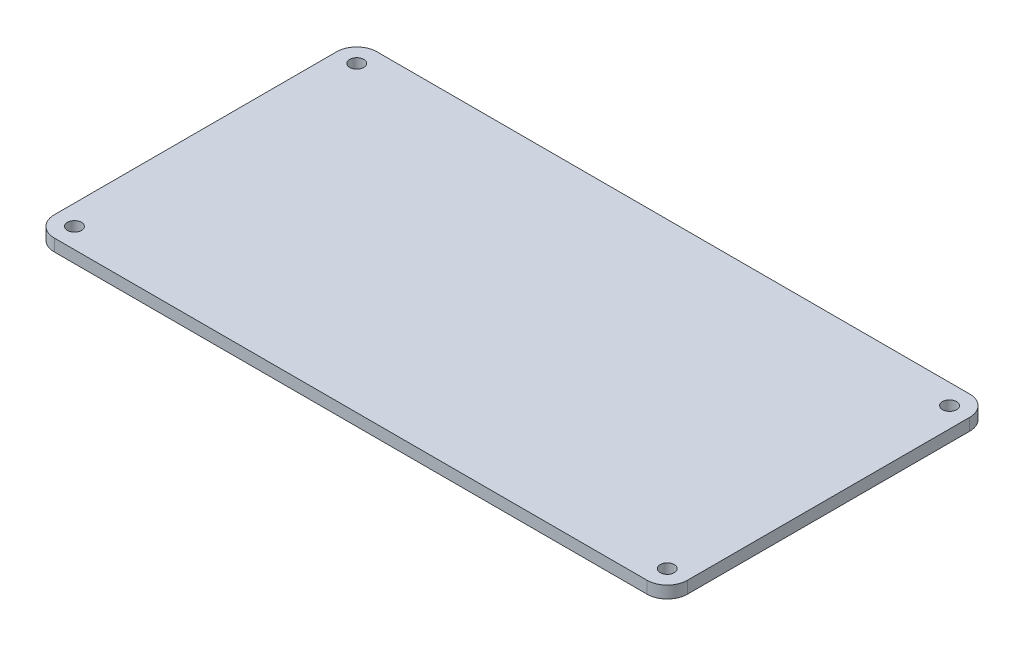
SolidWorks part; units mm, degrees
ref_plane "Front Plane" through (0, 0, 0) normal (0, 0, 1) x (1, 0, 0)
ref_plane "Top Plane" through (0, 0, 0) normal (0, 1, 0) x (1, 0, 0)
ref_plane "Right Plane" through (0, 0, 0) normal (1, 0, 0) x (0, 0, -1)
sketch "Sketch1" plane through (0, 0, 0) normal (0, 1, 0) x (1, 0, 0)
  line L0 (-1000, 0) -> (0, 0) construction
  line L1 (0, -30) -> (0, 30)
  line L2 (0, 30) -> (65, 30) construction
  line L3 (65, 30) -> (77, 40) construction
  line L4 (77, 40) -> (157, 40)
  line L15 (157, -40) -> (157, 40)
  line L16 (77, -40) -> (157, -40)
  line L17 (65, -30) -> (77, -40) construction
  line L18 (0, -30) -> (65, -30) construction
  line L19 (77, 40) -> (0, 40)
  line L20 (0, 40) -> (0, 30)
  line L21 (0, -30) -> (0, -40)
  line L22 (0, -40) -> (77, -40)
  point P6 (0, 0)
  dimension "D2" = 65
  dimension "D3" = 12
  dimension "D4" = 80
  dimension "D6" = 10
  dimension "D7" = 80
  dimension "D8" = 30
extrude "Boss-Extrude1" add sketch "Sketch1" along normal blind 3
fillet "Fillet1" radius 5 4 edges at (157, 1.5, 40) (0, 1.5, 40) (0, 1.5, -40) (157, 1.5, -40)
sketch "Sketch2" plane through (0, 3, 0) normal (0, 1, 0) x (1, 0, 0)
  circle A0 centre (5, 35) radius 1.75
  circle A1 centre (152, 35) radius 1.75
  circle A2 centre (152, -35) radius 1.75
  circle A3 centre (5, -35) radius 1.75
  dimension "D1" = 3.5
  dimension "D2" = 3.5
  dimension "D3" = 3.5
  dimension "D4" = 3.5
extrude "Cut-Extrude1" cut sketch "Sketch2" against normal blind 10
